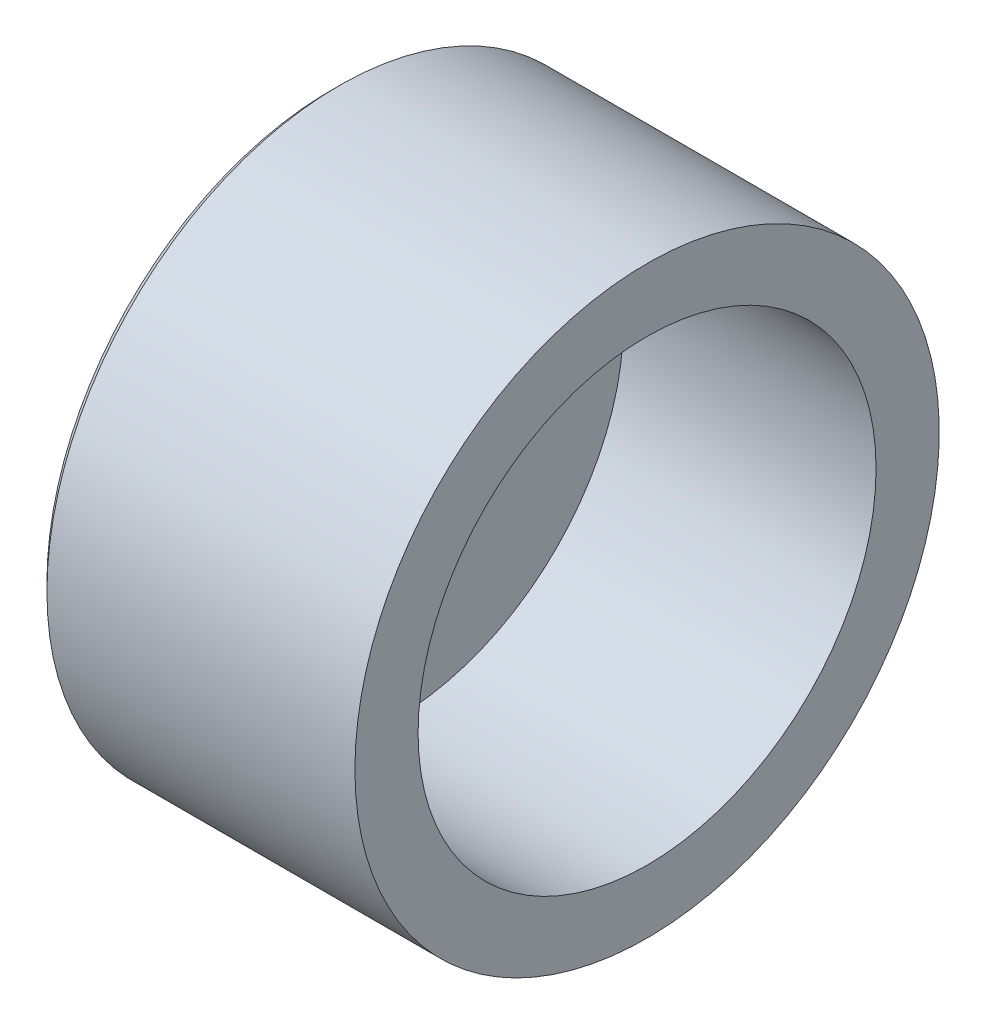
SolidWorks part; units mm, degrees
ref_plane "Face" through (0, 0, 0) normal (0, 0, 1) x (1, 0, 0)
ref_plane "Dessus" through (0, 0, 0) normal (0, 1, 0) x (1, 0, 0)
ref_plane "Droite" through (0, 0, 0) normal (1, 0, 0) x (0, 0, -1)
sketch "Esquisse1" plane through (0, 0, 0) normal (0, 0, 1) x (1, 0, 0)
  line L0 (0, 0) -> (52.743, 0) construction
  line L1 (0, 5.25) -> (0, 18)
  line L2 (0.5, 18.5) -> (16, 18.5)
  line L3 (20, 18.5) -> (20, 14.5)
  line L4 (20, 14.5) -> (4, 14.5)
  line L5 (4, 14.5) -> (4, 5.25)
  line L6 (4, 5.25) -> (0, 5.25)
  line L7 (0, 18) -> (0.5, 18.5)
  line L8 (16, 18.5) -> (20, 18.5)
  point P4 (0, 18.5)
  dimension "D1" = 10.5
  dimension "D2" = 4
  dimension "D3" = 4
  dimension "D4" = 37
  dimension "D5" = 16
  dimension "D10" = 0.5
revolve "Révolution1" add sketch "Esquisse1" angle 360 about L0
